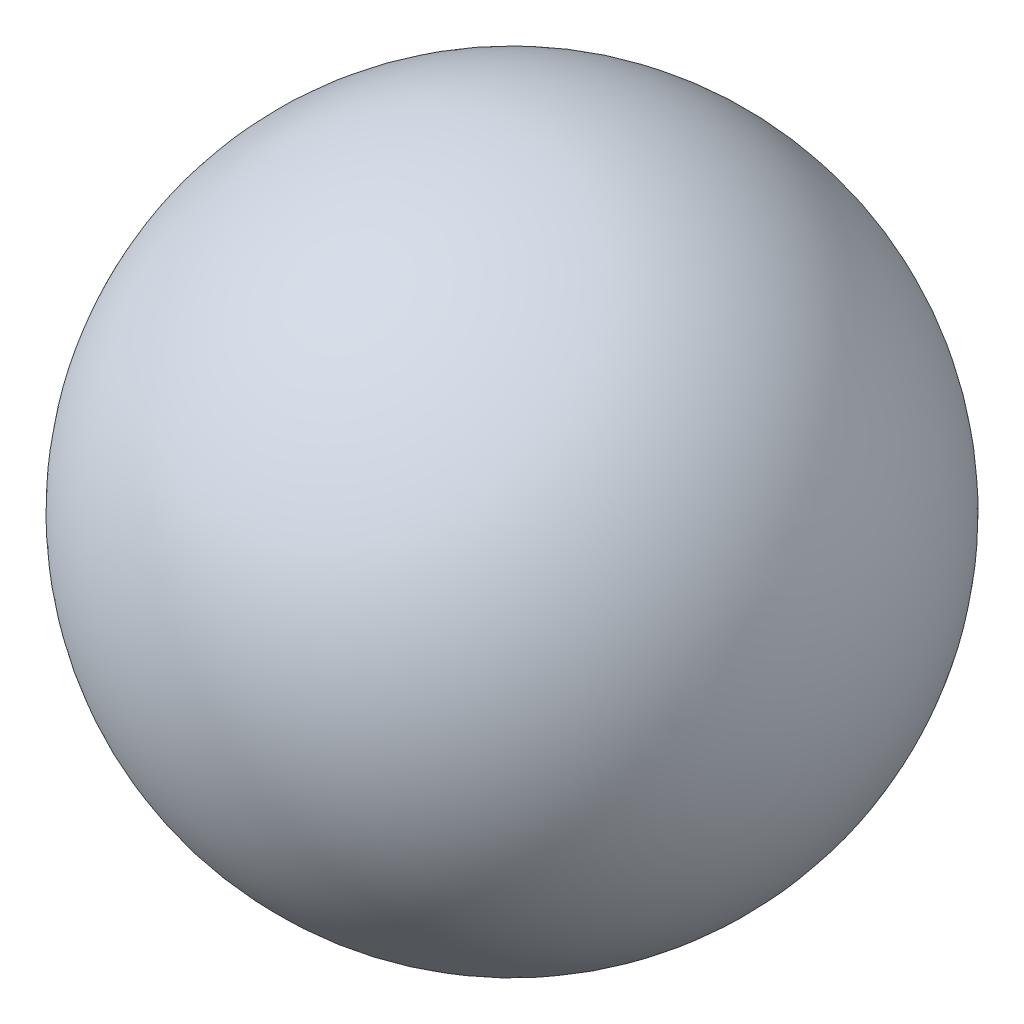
SolidWorks part; units mm, degrees
ref_plane "Plan1" through (0, 0, 0) normal (0, 0, 1) x (1, 0, 0)
ref_plane "Plan2" through (0, 0, 0) normal (0, 1, 0) x (1, 0, 0)
ref_plane "Plan3" through (0, 0, 0) normal (1, 0, 0) x (0, 0, -1)
sketch "Esquisse1" plane through (0, 0, 0) normal (0, 1, 0) x (1, 0, 0)
  line L1 (-0.3, 2.95) -> (5.7, 2.95) construction
  line L2 (-0.3, 5.9) -> (-0.3, 0) construction
  line L3 (5.7, 5.9) -> (5.7, 0) construction
  line L4 (0.75, 2.95) -> (4.65, 2.95)
  circle A1 centre (2.7, 2.95) radius 1.95 construction
  arc A2 (4.65, 2.95) -> (0.75, 2.95) centre (2.7, 2.95) ccw
revolve "Base-Révolution" add sketch "Esquisse1" angle 360 about L1
